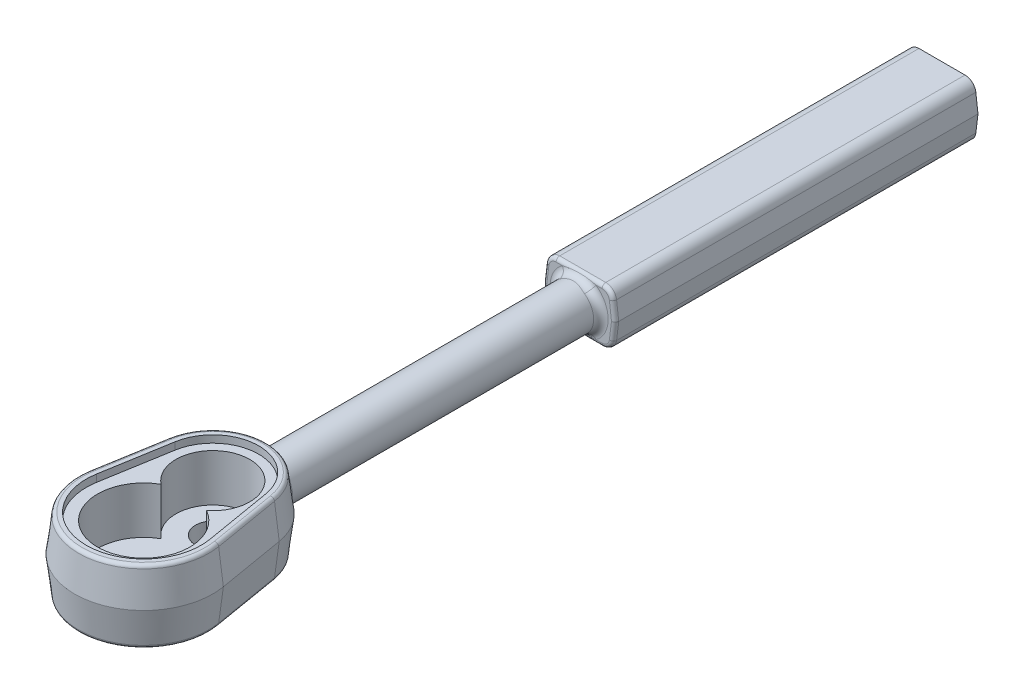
SolidWorks part; units mm, degrees
extrude "Head" add sketch "Sketch1" along normal mid plane 20 draft 7
sketch "Sketch1" plane through (0, 0, 0) normal (0, 1, 0) x (1, 0, 0)
  line L0 (-18.7836, 3.175) -> (-15.653, 21.6958)
  line L1 (15.653, 21.6958) -> (18.7836, 3.175)
  arc A0 (-15.653, 21.6958) -> (15.653, 21.6958) centre (0, 19.05) cw
  arc A1 (18.7836, 3.175) -> (-18.7836, 3.175) centre (0, 0) cw
  dimension "D1" = 15.875
  dimension "D2" = 19.05
  dimension "D3" = 19.05
ref_plane "Front" through (0, 0, 0) normal (0, 0, 1) x (1, 0, 0)
ref_plane "Top" through (0, 0, 0) normal (0, 1, 0) x (1, 0, 0)
ref_plane "Right" through (0, 0, 0) normal (1, 0, 0) x (0, 0, -1)
ref_plane "Trans Plane" through (0, 0, -120) normal (0, 0, 1) x (1, 0, 0)
sketch "Sketch14" plane through (0, 0, -120) normal (0, 0, 1) x (1, 0, 0)
  circle A0 centre (0, 0) radius 6
  dimension "D1" = 12
extrude "Transition" add sketch "Sketch14" along normal up to next
sketch "Sketch15" plane through (0, 0, -120) normal (0, 0, -1) x (-1, 0, 0)
  line L0 (0, 0) -> (0, 12.9966) construction
  line L1 (9.9209, 0) -> (9, 7.5)
  line L2 (-19.05, 0) -> (19.05, 0) construction
  line L3 (-9.9209, 0) -> (-9, 7.5)
  line L4 (9, 7.5) -> (-9, 7.5)
  line L5 (0, 0) -> (-22.7989, 0) construction
  line L6 (9.9209, 0) -> (9, -7.5)
  line L7 (9, -7.5) -> (-9, -7.5)
  line L8 (-9.9209, 0) -> (-9, -7.5)
extrude "Handle" add sketch "Sketch15" along normal blind 100
sketch "Sketch16" plane through (0, 10, 0) normal (0, 1, 0) x (-1, 0, 0)
  line L2 (-15.6009, -2.637) -> (-12.4703, -21.1579)
  line L3 (12.4703, -21.1579) -> (15.6009, -2.637)
  line L4 (-15.6009, -2.637) -> (-12.4703, -21.1579)
  line L5 (12.4703, -21.1579) -> (15.6009, -2.637)
  arc A2 (15.6009, -2.637) -> (-15.6009, -2.637) centre (0, 0) ccw
  arc A3 (-12.4703, -21.1579) -> (12.4703, -21.1579) centre (0, -19.05) ccw
  arc A4 (15.6009, -2.637) -> (-15.6009, -2.637) centre (0, 0) ccw
  arc A5 (-12.4703, -21.1579) -> (12.4703, -21.1579) centre (0, -19.05) ccw
  dimension "D1" = 2
extrude "Recess" cut sketch "Sketch16" against normal blind 2
sketch "Sketch17" plane through (0, 8, 0) normal (0, 1, 0) x (-1, 0, 0)
  arc A0 (-6.2618, -11.049) -> (6.2618, -11.049) centre (0, -19.05) ccw
  arc A1 (6.2618, -11.049) -> (-6.2618, -11.049) centre (0, 0) ccw
  arc A2 (15.6009, -2.637) -> (-15.6009, -2.637) centre (0, 0) ccw construction
  dimension "D1" = 10.16
  dimension "D2" = 12.7
extrude "Pocket" cut sketch "Sketch17" against normal blind 13
sketch "Sketch18" plane through (0, -5, 0) normal (0, 1, 0) x (-1, 0, 0)
  circle A0 centre (0, -19.05) radius 4.7625
  dimension "D1" = 9.525
extrude "Wheel Hole" cut sketch "Sketch18" against normal through all
sketch "Sketch19" plane through (-1.3849, -5, 12.9281) normal (0, 1, 0) x (-1, 0, 0)
  circle A0 centre (-1.3849, -12.9281) radius 5.715
  dimension "D1" = 11.43
extrude "Ratchet Hole" cut sketch "Sketch19" against normal through all
fillet "Handle Fillets" radius 3 4 edges at (-9, -7.5, -170) (-9, 7.5, -170) (9, 7.5, -170) (9, -7.5, -170)
fillet "H End Fillets" radius 1 18 edges at (0, 10, -33.6972) (16.0076, 10, -12.2308) (0, -10, 17.8222) (-16.0076, -10, -12.2308) (0, -10, -33.6972) (16.0076, -10, -12.2308) (-9.6222, -2.4328, -120) (9.6222, 2.4328, -120) (-9.6222, 2.4328, -120) (9.6222, -2.4328, -120) (0, 10, 17.8222) (-16.0076, 10, -12.2308) (0, 7.5, -120) (0, -7.5, -120) (8.3337, -6.7469, -120) (-8.3337, -6.7469, -120) (8.3337, 6.7469, -120) (-8.3337, 6.7469, -120)
fillet "T-H Fillets" radius 2 3 edges at (0.3526, 5.9896, -34.1855) (0.3526, -5.9896, -34.1855) (6, 0, -120)
equation "\"Draft@Sketch15\" = \"Draft@Head\""
